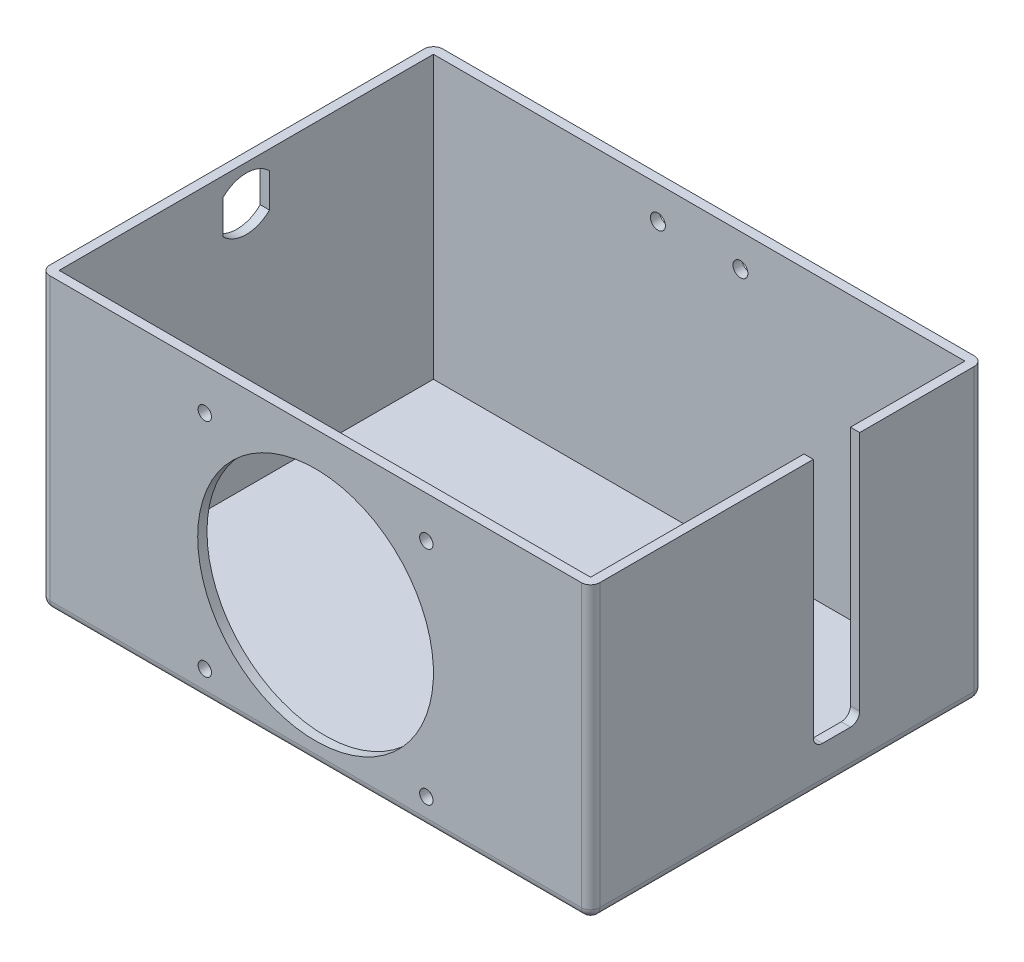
SolidWorks part; units mm, degrees
ref_plane "Front Plane" through (0, 0, 0) normal (0, 0, 1) x (1, 0, 0)
ref_plane "Top Plane" through (0, 0, 0) normal (0, 1, 0) x (1, 0, 0)
ref_plane "Right Plane" through (0, 0, 0) normal (1, 0, 0) x (0, 0, -1)
ref_plane "Plane1" through (0, 93.98, 0) normal (0, 1, 0) x (1, 0, 0)
sketch "Sketch1" plane through (0, 93.98, 0) normal (0, 1, 0) x (1, 0, 0)
  line L0 (-88.9, -63.5) -> (88.9, -63.5)
  line L1 (88.9, -63.5) -> (88.9, 63.5)
  line L2 (88.9, 63.5) -> (-88.9, 63.5)
  line L3 (-88.9, 63.5) -> (-88.9, -63.5)
extrude "Boss-Extrude1" add sketch "Sketch1" against normal blind 93.98
sketch "Sketch2" plane through (0, 93.98, 0) normal (0, 1, 0) x (-1, 0, 0)
  line L0 (85.9, 60.5) -> (-85.9, 60.5)
  line L1 (-85.9, 60.5) -> (-85.9, -60.5)
  line L2 (-85.9, -60.5) -> (85.9, -60.5)
  line L3 (85.9, -60.5) -> (85.9, 60.5)
extrude "Cut-Extrude1" cut sketch "Sketch2" against normal blind 90.98
sketch "Sketch3" plane through (85.9, 0, 0) normal (-1, 0, 0) x (0, 0, 1)
  line L0 (-23.5, 93.98) -> (-23.5, 13)
  line L1 (-23.5, 13) -> (-8.5, 13)
  line L2 (-8.5, 13) -> (-8.5, 93.98)
  line L3 (-8.5, 93.98) -> (-23.5, 93.98)
extrude "Cut-Extrude2" cut sketch "Sketch3" against normal through all
sketch "Sketch4" plane through (-85.9, 0, 0) normal (1, 0, 0) x (0, 0, -1)
  line L0 (7.5, 76.8734) -> (7.5, 87.8734)
  line L1 (-7.5, 87.8734) -> (-7.5, 76.8734)
  arc A0 (-7.5, 76.8734) -> (7.5, 76.8734) centre (0, 84.3734) ccw
  arc A1 (7.5, 87.8734) -> (-7.5, 87.8734) centre (0, 80.3734) ccw
extrude "Cut-Extrude3" cut sketch "Sketch4" against normal through all
hole_wizard "M4 Clearance Hole1" positions "Sketch6" profile "Sketch5" hole size "M4" standard "ANSI Metric"
sketch "Sketch6" plane through (0, 0, 60.5) normal (0, 0, -1) x (-1, 0, 0)
  point P0 (35.809, 80.604)
  point P1 (-35.809, 8.986)
  point P2 (35.809, 8.986)
  point P3 (-35.809, 80.604)
sketch "Sketch5" plane through (-35.809, 80.604, 60.5) normal (1, 0, 0) x (0, 1, 0)
  line L0 (0, 0) -> (0, 3)
  line L1 (0, 3) -> (2.159, 3)
  line L2 (2.159, 3) -> (2.159, 0)
  line L5 (2.159, 0) -> (0, 0)
  line L11 (0, -6.35) -> (0, 107.95) construction
  dimension "Thru Hole Dia." = 4.318
  dimension "Thru Hole Depth" = 3
hole_wizard "M72 Clearance Hole1" positions "Sketch8" profile "Sketch7" hole size "M72" standard "ANSI Metric"
sketch "Sketch8" plane through (0, 0, 60.5) normal (0, 0, -1) x (-1, 0, 0)
  point P0 (0, 44.795)
sketch "Sketch7" plane through (0, 44.795, 60.5) normal (1, 0, 0) x (0, 1, 0)
  line L0 (0, 0) -> (0, 3)
  line L1 (0, 3) -> (38.1, 3)
  line L2 (38.1, 3) -> (38.1, 0)
  line L5 (38.1, 0) -> (0, 0)
  line L11 (0, -6.35) -> (0, 107.95) construction
  dimension "Thru Hole Dia." = 76.2
  dimension "Thru Hole Depth" = 3
fillet "Fillet1" radius 3 10 edges at (88.9, 46.99, 63.5) (-88.9, 46.99, 63.5) (0, 0, 63.5) (-88.9, 46.99, -63.5) (88.9, 0, 0) (88.9, 46.99, -63.5) (-88.9, 0, 0) (0, 0, -63.5) (87.4, 13, -23.5) (87.4, 13, -8.5)
sketch "Sketch9" plane through (0, 0, -63.5) normal (0, 0, -1) x (-1, 0, 0)
  line L0 (0, 0) -> (0, 93.98) construction
  line L1 (-19.05, 93.98) -> (19.05, 93.98)
  line L5 (55, 93.98) -> (-55, 93.98) construction
  circle A0 centre (-13.335, 83.439) radius 2.413
  circle A1 centre (13.335, 83.439) radius 2.413
  point P9 (0, 93.98)
  dimension "D5" = 4.826
extrude "Cut-Extrude4" cut sketch "Sketch9" against normal up to surface (3 mm away) contours A1 | A0
